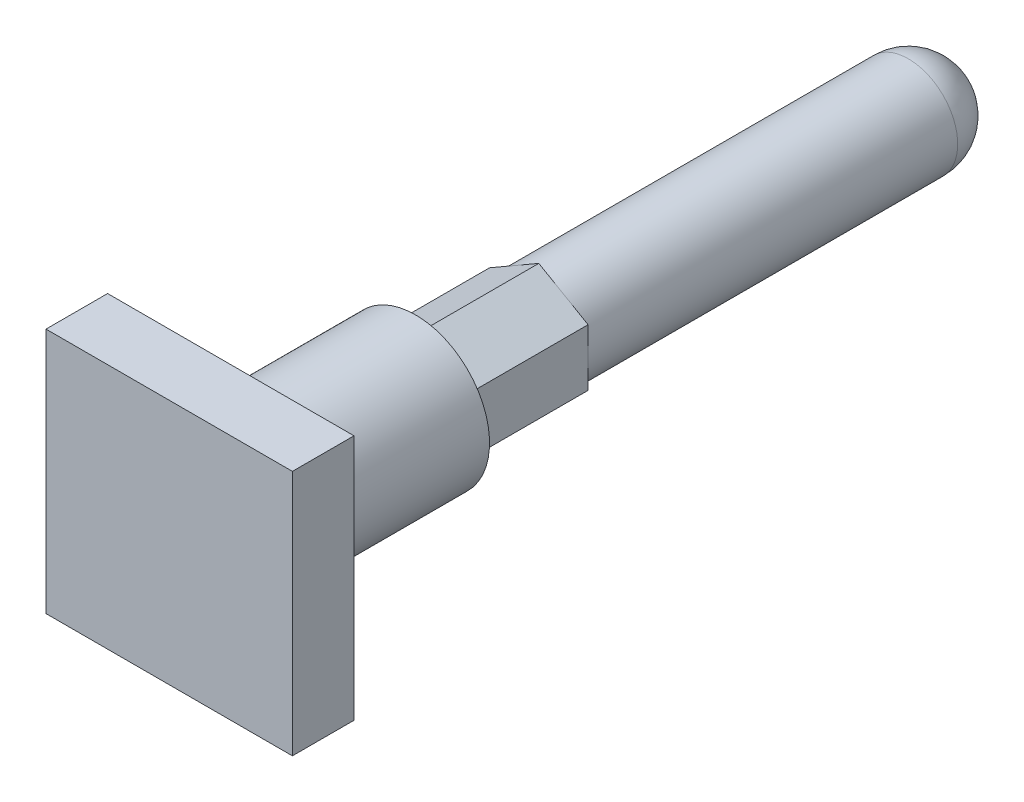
SolidWorks part; units mm, degrees
ref_plane "Front Plane" through (0, 0, 0) normal (0, 0, 1) x (1, 0, 0)
ref_plane "Top Plane" through (0, 0, 0) normal (0, 1, 0) x (1, 0, 0)
ref_plane "Right Plane" through (0, 0, 0) normal (1, 0, 0) x (0, 0, -1)
sketch "Sketch12" plane through (0, 0, 0) normal (0, 0, 1) x (1, 0, 0)
  line L1 (-10, -10) -> (10, -10)
  line L2 (-10, -10) -> (-10, 10)
  line L3 (-10, 10) -> (10, 10)
  line L4 (10, -10) -> (10, 10)
  line L5 (-10, -10) -> (10, 10) construction
  line L6 (-10, 10) -> (10, -10) construction
  point P0 (0, 0)
  dimension "D1" = 20
extrude "Boss-Extrude10" add sketch "Sketch12" along normal blind 5
sketch "Sketch13" plane through (0, 0, 0) normal (0, 0, -1) x (-1, 0, 0)
  circle A0 centre (0, 0) radius 6
  dimension "D1" = 12
extrude "Boss-Extrude11" add sketch "Sketch13" along normal blind 15
sketch "Sketch14" plane through (0, 0, -15) normal (0, 0, -1) x (-1, 0, 0)
  line L0 (10, 10) -> (10, -10) construction
  line L1 (4, 2.3094) -> (0, 4.6188)
  line L2 (0, 4.6188) -> (-4, 2.3094)
  line L3 (-4, 2.3094) -> (-4, -2.3094)
  line L4 (-4, -2.3094) -> (0, -4.6188)
  line L5 (0, -4.6188) -> (4, -2.3094)
  line L6 (4, -2.3094) -> (4, 2.3094)
  circle A0 centre (0, 0) radius 4 construction
  dimension "D1" = 8
extrude "Boss-Extrude12" add sketch "Sketch14" along normal blind 10
sketch "Sketch15" plane through (0, 0, -25) normal (0, 0, -1) x (-1, 0, 0)
  circle A0 centre (0, 0) radius 4
  dimension "D1" = 8
extrude "Boss-Extrude13" add sketch "Sketch15" along normal blind 30
sketch "Sketch16" plane through (0, 0, 0) normal (0, 1, 0) x (1, 0, 0)
  line L2 (4, 55) -> (-4, 55) construction
  line L3 (4, 55) -> (-4, 55)
  arc A0 (-4, 55) -> (4, 55) centre (0, 55) cw
revolve "Revolve2" add sketch "Sketch16" angle 360 about L3
